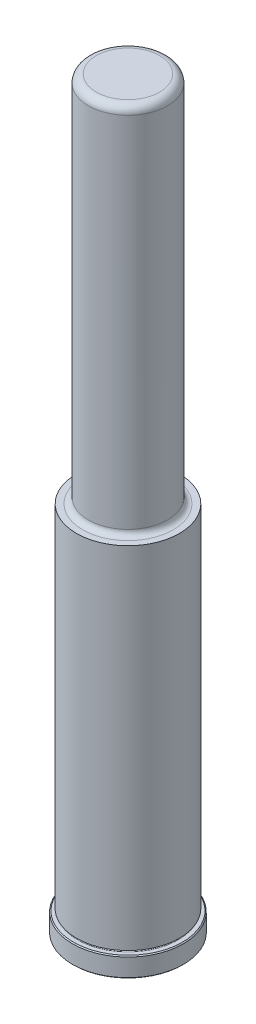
SolidWorks part; units mm, degrees
ref_plane "Front Plane" through (0, 0, 0) normal (0, 0, 1) x (1, 0, 0)
ref_plane "Top Plane" through (0, 0, 0) normal (0, 1, 0) x (1, 0, 0)
ref_plane "Right Plane" through (0, 0, 0) normal (1, 0, 0) x (0, 0, -1)
sketch "Sketch1" plane through (0, 0, 0) normal (1, 0, 0) x (0, 0, -1)
  line L0 (0, 0) -> (22.225, 0)
  line L1 (22.225, 0) -> (22.225, 7.9248)
  line L2 (22.225, 7.9248) -> (20.2438, 7.9248)
  line L3 (19.8628, 2.6782) -> (19.8628, 5.9795) construction
  line L4 (20.2438, 8.6868) -> (20.6502, 8.6868)
  line L5 (20.6502, 8.6868) -> (20.6502, 149.225)
  line L6 (20.6502, 149.225) -> (18.1483, 149.225)
  line L7 (15.8623, 151.511) -> (15.8623, 298.45)
  line L9 (15.8623, 298.45) -> (0, 298.45)
  line L10 (0, 298.45) -> (0, 0)
  line L11 (0, 0) -> (0, -7.2694) construction
  arc A0 (20.2438, 8.6868) -> (20.2438, 7.9248) centre (20.2438, 8.3058) ccw
  arc A1 (18.1483, 149.225) -> (15.8623, 151.511) centre (18.1483, 151.511) cw
  point P2 (15.8623, 298.45)
  point P14 (15.8623, 298.1254)
  point P19 (15.8623, 149.225)
  dimension "D14" = 0.762
  dimension "D8" = 2.286
  dimension "T" = 7.9248
  dimension "D2" = 0.762
  dimension "M" = 44.45
  dimension "B" = 41.3004
  dimension "L" = 298.45
  dimension "D7" = 0.7874
  dimension "A" = 149.225
  dimension "D" = 31.7246
  dimension "D15" = 149.225
revolve "Revolve1" add sketch "Sketch1" angle 360 about L11
chamfer "Chamfer1" distance 0.381 angle 45 2 edges at (0, 0, 22.225) (0, 7.9248, 22.225)
fillet "Fillet1" radius 3.175 1 edges at (0, 298.45, 15.8623)
